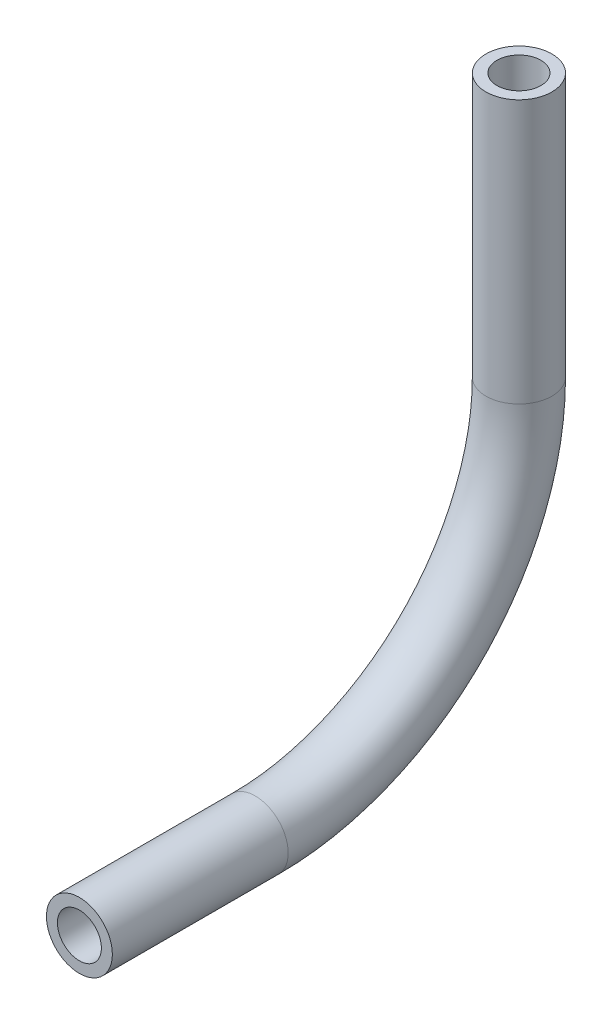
SolidWorks part; units mm, degrees
ref_plane "Front Plane" through (0, 0, 0) normal (0, 0, 1) x (1, 0, 0)
ref_plane "Top Plane" through (0, 0, 0) normal (0, 1, 0) x (1, 0, 0)
ref_plane "Right Plane" through (0, 0, 0) normal (1, 0, 0) x (0, 0, -1)
sketch "Sketch1" plane through (0, 0, 0) normal (0, 0, 1) x (1, 0, 0)
  circle A0 centre (0, 0) radius 9.525
  circle A1 centre (0, 0) radius 6.35
  dimension "D1" = 3.175
  dimension "D2" = 19.05
sketch "Sketch2" plane through (0, 0, 0) normal (1, 0, 0) x (0, 0, -1)
  line L0 (0, 0) -> (50.8, 0)
  line L1 (127, 76.2) -> (127, 152.3293)
  line L2 (194.8793, 203.1293) -> (-741.0419, 203.1293) construction
  arc A0 (50.8, 0) -> (127, 76.2) centre (50.8, 76.2) ccw
  point P6 (127, 0)
  dimension "D3" = 76.2
  dimension "D1" = 50.8
  dimension "D2" = 50.8
sweep "Sweep1" add profiles "Sketch1" path "Sketch2"
